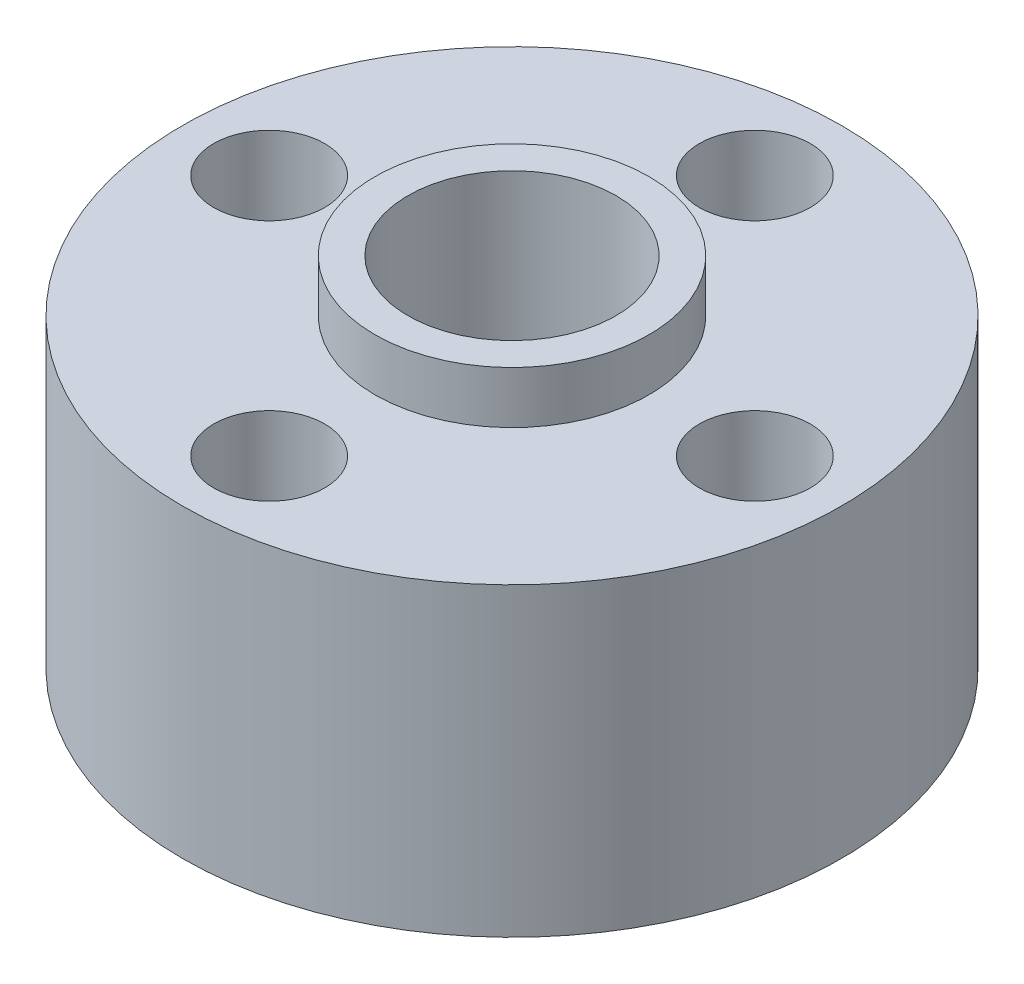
SolidWorks part; units mm, degrees
ref_plane "前视基准面" through (0, 0, 0) normal (0, 0, 1) x (1, 0, 0)
ref_plane "上视基准面" through (0, 0, 0) normal (0, 1, 0) x (1, 0, 0)
ref_plane "右视基准面" through (0, 0, 0) normal (1, 0, 0) x (0, 0, -1)
ref_plane "基准面4" through (0, 0, 0) normal (0, 0, -1) x (-1, 0, 0)
sketch "草图1" plane through (0, 0, 0) normal (0, 0, -1) x (-1, 0, 0)
  line L0 (-9.5, -4.375) -> (0, -4.375)
  line L1 (0, -4.375) -> (0, 4.425)
  line L2 (0, 4.425) -> (-9.5, 4.425)
  line L3 (-9.5, 4.425) -> (-9.5, -4.375)
  line L4 (0, -4.375) -> (0, 4.425) construction
revolve "旋转1" add sketch "草图1" angle 360 about L4
sketch "草图2" plane through (0, 4.425, 0) normal (0, 1, 0) x (-1, 0, 0)
  circle A0 centre (0, 0) radius 3.95
extrude "凸台-拉伸1" add sketch "草图2" along normal blind 1.5
sketch "草图3" plane through (0, -4.375, 0) normal (0, -1, 0) x (1, 0, 0)
  circle A0 centre (0, 0) radius 3.95
extrude "凸台-拉伸2" add sketch "草图3" along normal blind 1.5
hole_wizard "Ø3.2 (3.2) 直径孔1" positions "草图5" profile "草图4" hole size "Ø3.2" standard "ANSI Metric"
sketch "草图5" plane through (0, -4.375, 0) normal (0, -1, 0) x (-1, 0, 0)
  point P0 (0, 7)
  point P1 (-7, 0)
  point P2 (0, -7)
  point P3 (7, 0)
sketch "草图4" plane through (0, -4.375, -7) normal (1, 0, 0) x (0, 0, -1)
  line L0 (0, 0) -> (0, 10.3)
  line L1 (0, 10.3) -> (1.6, 10.3)
  line L2 (1.6, 10.3) -> (1.6, 0)
  line L5 (1.6, 0) -> (0, 0)
  line L11 (0, -6.35) -> (0, 107.95) construction
  dimension "通孔孔直径" = 3.2
  dimension "通孔孔深度" = 10.3
hole_wizard "Ø6.0 (6) 直径孔1" positions "草图7" profile "草图6" hole size "Ø6.0" standard "ANSI Metric"
sketch "草图7" plane through (0, -5.875, 0) normal (0, -1, 0) x (-1, 0, 0)
  point P0 (0, 0)
sketch "草图6" plane through (0, -5.875, 0) normal (1, 0, 0) x (0, 0, -1)
  line L0 (0, 0) -> (0, 11.8)
  line L1 (0, 11.8) -> (3, 11.8)
  line L2 (3, 11.8) -> (3, 0)
  line L5 (3, 0) -> (0, 0)
  line L11 (0, -6.35) -> (0, 107.95) construction
  dimension "通孔孔直径" = 6
  dimension "通孔孔深度" = 11.8
